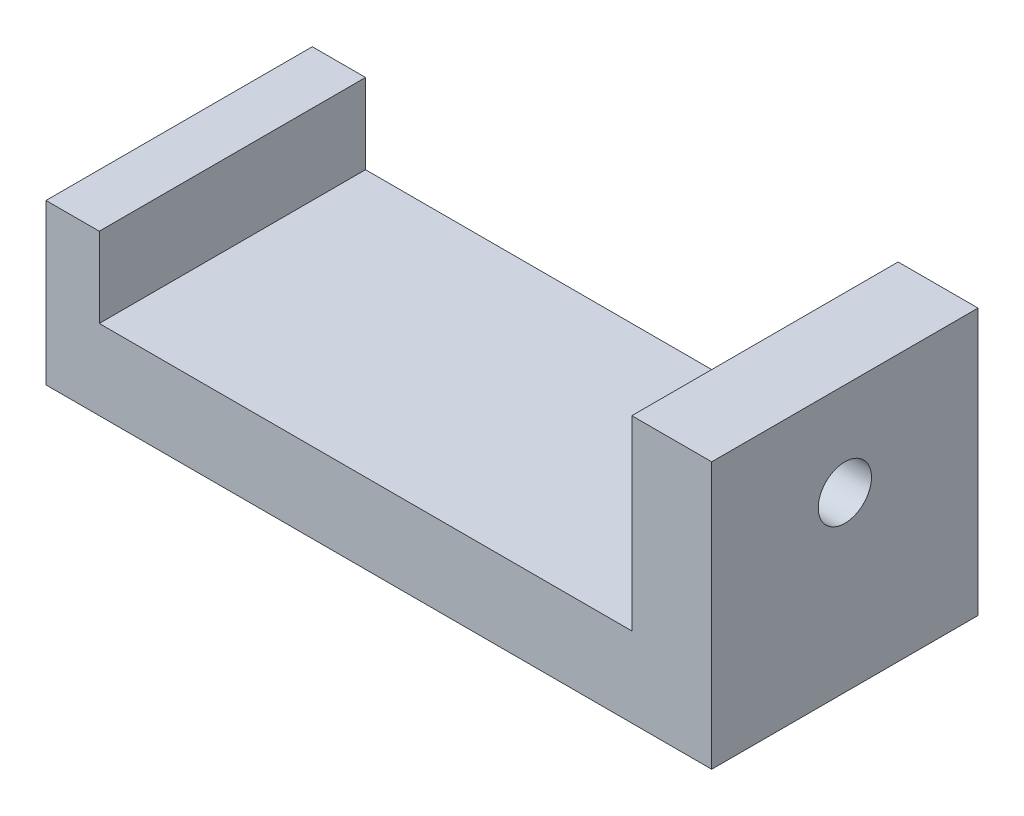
SolidWorks part; units mm, degrees
ref_plane "Ebene vorne" through (0, 0, 0) normal (0, 0, 1) x (1, 0, 0)
ref_plane "Ebene oben" through (0, 0, 0) normal (0, 1, 0) x (1, 0, 0)
ref_plane "Ebene rechts" through (0, 0, 0) normal (1, 0, 0) x (0, 0, -1)
sketch "Skizze1" plane through (0, 0, 0) normal (0, 0, 1) x (1, 0, 0)
  line L0 (0, 30) -> (0, 0)
  line L1 (0, 0) -> (125, 0)
  line L2 (125, 0) -> (125, 50)
  line L3 (125, 50) -> (110, 50)
  line L4 (110, 50) -> (110, 15)
  line L5 (110, 15) -> (10, 15)
  line L6 (10, 15) -> (10, 30)
  line L7 (10, 30) -> (0, 30)
  dimension "D1" = 10
  dimension "D2" = 15
  dimension "D3" = 50
  dimension "D4" = 15
  dimension "D5" = 125
  dimension "D6" = 30
extrude "Linear austragen1" add sketch "Skizze1" along normal blind 50
hole_wizard "Ø10.0 (10) Durchmesser Bohrung1" positions "Skizze3" profile "Skizze2" hole size "Ø10.0" standard "DIN"
sketch "Skizze3" plane through (125, 0, 0) normal (1, 0, 0) x (0, 0, -1)
  line L0 (0, 0) -> (0, 50) construction
  line L1 (-50, 50) -> (0, 50) construction
  point P0 (-25, 32.5)
  dimension "D1" = 25
  dimension "D2" = 17.5
sketch "Skizze2" plane through (125, 32.5, 25) normal (0, 1, 0) x (0, 0, -1)
  line L0 (0, 0) -> (0, 28.0043)
  line L1 (0, 28.0043) -> (5, 25)
  line L2 (5, 25) -> (5, 0)
  line L5 (5, 0) -> (0, 0)
  line L10 (0, 28.0043) -> (-5, 25) construction
  line L11 (0, -6.35) -> (0, 107.95) construction
  dimension "Bohrerdurchmesser" = 10
  dimension "Bohrungstiefe" = 25
  dimension "Spitzenwinkel" = 118
